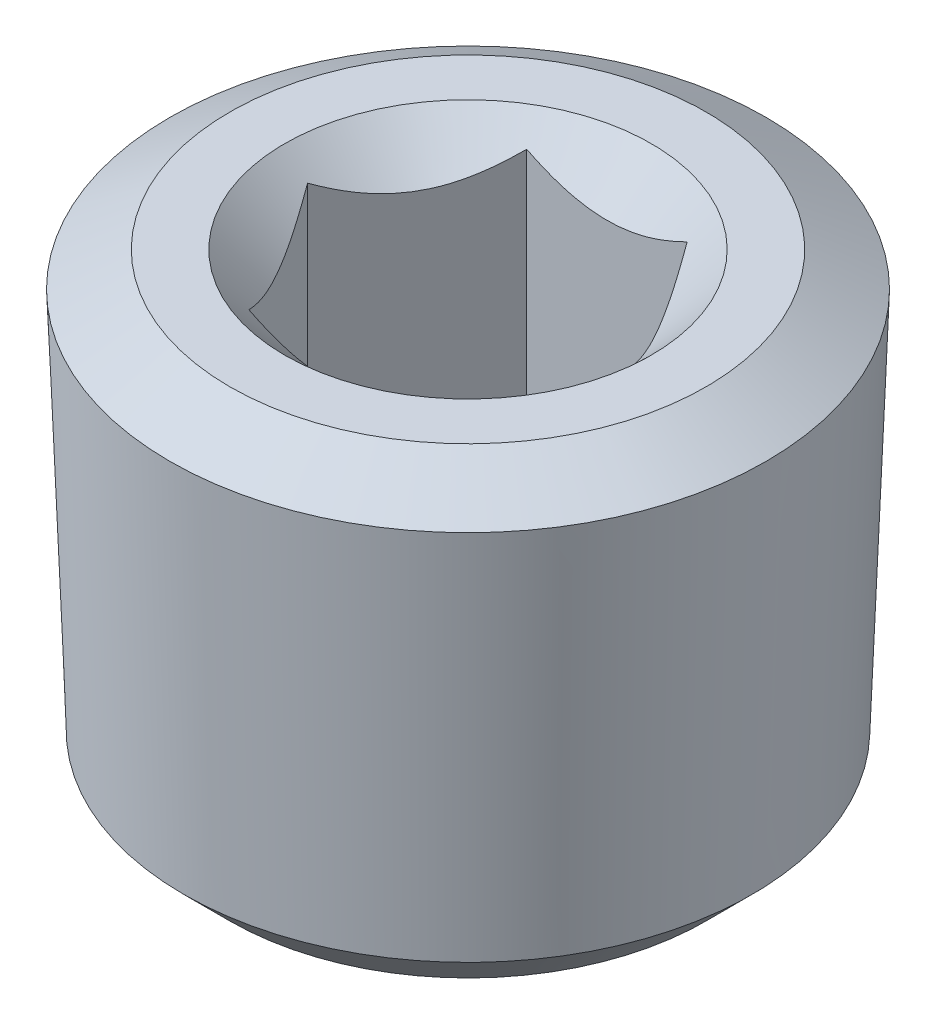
SolidWorks part; units mm, degrees
ref_plane "Front Plane" through (0, 0, 0) normal (0, 0, 1) x (1, 0, 0)
ref_plane "Top Plane" through (0, 0, 0) normal (0, 1, 0) x (1, 0, 0)
ref_plane "Right Plane" through (0, 0, 0) normal (1, 0, 0) x (0, 0, -1)
sketch "Sketch2" plane through (0, 0, 0) normal (0, 0, 1) x (1, 0, 0)
  line L0 (0, 10.7443) -> (0, -17.0657) construction
  line L1 (0, 0) -> (-4.0916, 0)
  line L2 (-5.1218, -0.5948) -> (-4.8825, -7.1594)
  line L3 (-4.0916, -7.9502) -> (0, -7.9502)
  line L4 (0, -7.9502) -> (0, 0)
  line L6 (-4.0916, -7.9502) -> (-4.8825, -7.1594)
  line L7 (-4.0916, 0) -> (-5.1218, -0.5948)
  point P4 (-5.1435, 0)
  point P6 (-4.8536, -7.9502)
  dimension "D1" = 7.9502
  dimension "D2" = 2.088
  dimension "D3" = 10.287
  dimension "D4" = 30
  dimension "D5" = 0.762
  dimension "D6" = 45
revolve "Revolve1" add sketch "Sketch2" angle 360 about L0
sketch "Sketch3" plane through (0, 0, 0) normal (0, 0, 1) x (1, 0, 0)
  line L0 (0, 2.9342) -> (0, -8.1202) construction
  line L1 (0, 0) -> (-3.1496, 0)
  line L2 (4.0916, 0) -> (-4.0916, 0) construction
  line L3 (-2.3876, -0.762) -> (-2.3876, -6.35)
  line L4 (-2.3876, -6.35) -> (-1.9649, -6.604)
  line L5 (0, -6.604) -> (0, 0)
  line L6 (-2.3876, -0.762) -> (-3.1496, 0)
  line L8 (-1.9649, -6.604) -> (0, -6.604)
  dimension "D1" = 6.35
  dimension "D2" = 59
  dimension "D3" = 4.7752
  dimension "D4" = 0.762
  dimension "D5" = 45
  dimension "D6" = 6.604
revolve "Cut-Revolve1" cut sketch "Sketch3" angle 360 about L0
sketch "Sketch4" plane through (0, 0, 0) normal (0, 1, 0) x (1, 0, 0)
  line L1 (-1.3785, -2.3876) -> (1.3785, -2.3876)
  line L2 (1.3785, -2.3876) -> (2.757, 0)
  line L3 (2.757, 0) -> (1.3785, 2.3876)
  line L4 (1.3785, 2.3876) -> (-1.3785, 2.3876)
  line L5 (-1.3785, 2.3876) -> (-2.757, 0)
  line L6 (-2.757, 0) -> (-1.3785, -2.3876)
  circle A0 centre (0, 0) radius 2.3876 construction
  circle A1 centre (0, 0) radius 2.3876 construction
extrude "Cut-Extrude1" cut sketch "Sketch4" against normal up to vertex (5.2929 mm away)
